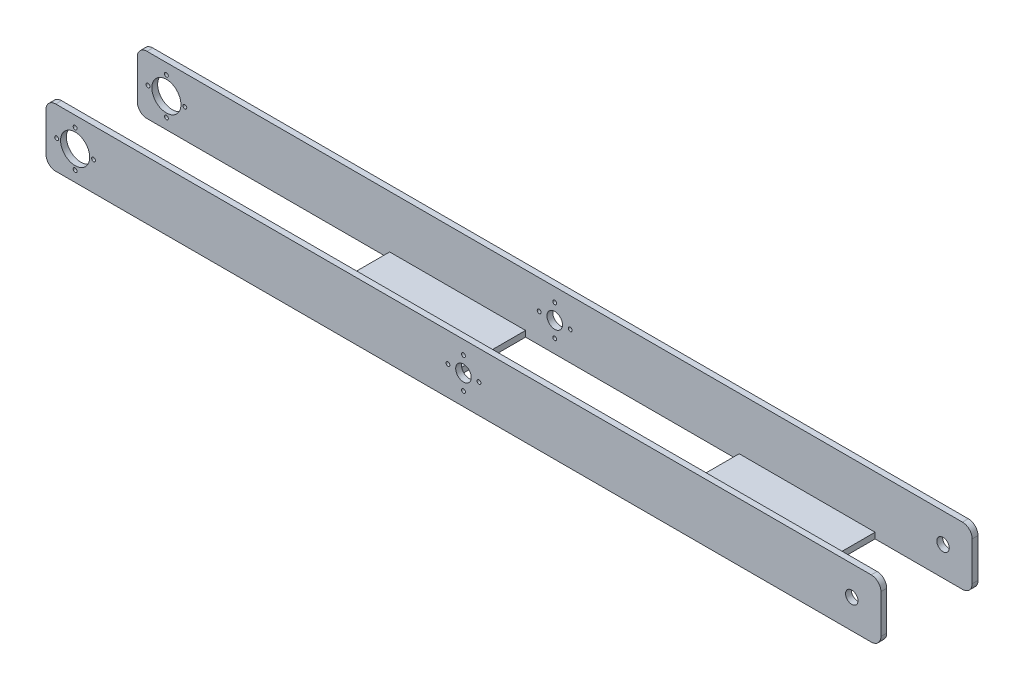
SolidWorks part; units mm, degrees
ref_plane "Front Plane" through (0, 0, 0) normal (0, 0, 1) x (1, 0, 0)
ref_plane "Top Plane" through (0, 0, 0) normal (0, 1, 0) x (1, 0, 0)
ref_plane "Right Plane" through (0, 0, 0) normal (1, 0, 0) x (0, 0, -1)
sketch "Sketch1" plane through (0, 0, 0) normal (0, 0, 1) x (1, 0, 0)
  line L1 (-215, -15) -> (215, -15)
  line L2 (-215, -15) -> (-215, 15)
  line L3 (-215, 15) -> (215, 15)
  line L4 (215, -15) -> (215, 15)
  line L5 (-215, -15) -> (215, 15) construction
  line L6 (-215, 15) -> (215, -15) construction
  point P0 (0, 0)
  dimension "420" = 430
  dimension "D2" = 30
extrude "Boss-Extrude1" add sketch "Sketch1" along normal blind 50
shell "Shell3" thickness 3
sketch "Sketch2" plane through (0, -12, 0) normal (0, 1, 0) x (1, 0, 0)
  line L0 (215, 0) -> (-215, 0) construction
  line L5 (215, -50) -> (-215, -50) construction
  line L6 (215, -50) -> (215, -47) construction
  line L7 (-15, -3) -> (95, -3)
  line L8 (-15, -3) -> (-15, -47)
  line L13 (215, -3) -> (165, -3)
  line L14 (215, -3) -> (215, -47)
  line L15 (215, -47) -> (165, -47)
  line L16 (165, -3) -> (165, -47)
  line L25 (-215, -3) -> (-85, -3)
  line L26 (-215, -3) -> (-215, -47)
  line L27 (-85, -3) -> (-85, -47)
  line L28 (-215, -47) -> (-85, -47)
  line L29 (-215, -50) -> (-215, -47) construction
  line L30 (95, -3) -> (95, -47)
  line L31 (-15, -47) -> (95, -47)
  dimension "D2" = 3
  dimension "D3" = 3
  dimension "D4" = 130
  dimension "D5" = 200
  dimension "D6" = 50
  dimension "D7" = 120
  dimension "D8" = 3
  dimension "2" = 3
  dimension "D10" = 3
extrude "Cut-Extrude7" cut sketch "Sketch2" against normal up to next
sketch "Sketch3" plane through (0, 0, 0) normal (0, 0, -1) x (-1, 0, 0)
  line L0 (0, 0) -> (0, 15) construction
  line L1 (-215, 15) -> (215, 15) construction
  line L2 (0, 0) -> (0, -15) construction
  line L3 (215, -15) -> (-215, -15) construction
  line L4 (0, 0) -> (215, 0) construction
  line L5 (215, 15) -> (215, -15) construction
  line L6 (0, 0) -> (-215, 0) construction
  line L7 (-215, -15) -> (-215, 15) construction
  circle A0 centre (0, 0) radius 4
  circle A1 centre (0, 8) radius 1
  circle A2 centre (0, -8) radius 1
  circle A3 centre (8, 0) radius 1
  circle A4 centre (-8, 0) radius 1
  circle A5 centre (200, 0) radius 7.5
  circle A6 centre (-200, 0) radius 3.2
  circle A7 centre (200, 9.5) radius 1
  circle A8 centre (209.5, 0) radius 1
  circle A9 centre (190.5, 0) radius 1
  circle A10 centre (200, -9.5) radius 1
  dimension "D1" = 8
  dimension "D6" = 2
  dimension "D7" = 2
  dimension "D8" = 2
  dimension "D9" = 2
  dimension "D13" = 15
  dimension "D15" = 6.4
  dimension "D16" = 2
  dimension "D17" = 2
  dimension "D18" = 2
  dimension "D19" = 2
  dimension "D2" = 8
  dimension "D3" = 8
  dimension "D4" = 9.5
  dimension "D5" = 9.5
  dimension "D10" = 200
  dimension "D11" = 9.5
  dimension "D12" = 9.5
  dimension "D14" = 200
extrude "Cut-Extrude2" cut sketch "Sketch3" against normal through all
fillet "Fillet1" radius 5 8 edges at (-215, -15, 1.5) (-215, 15, 1.5) (-215, -15, 48.5) (-215, 15, 48.5) (215, -15, 48.5) (215, -15, 1.5) (215, 15, 1.5) (215, 15, 48.5)
